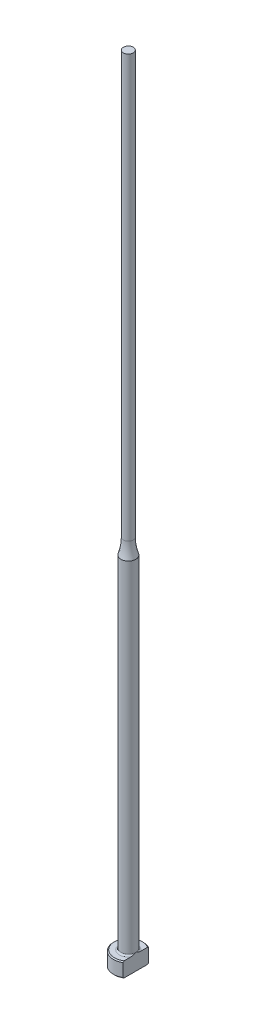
SolidWorks part; units mm, degrees
ref_plane "Front Plane" through (0, 0, 0) normal (0, 0, 1) x (1, 0, 0)
ref_plane "Top Plane" through (0, 0, 0) normal (0, 1, 0) x (1, 0, 0)
ref_plane "Right Plane" through (0, 0, 0) normal (1, 0, 0) x (0, 0, -1)
sketch "Sketch1" plane through (0, 0, 0) normal (0, 0, 1) x (1, 0, 0)
  line L0 (0, 259.9588) -> (0, -15.1925) construction
  line L1 (0, 0) -> (-3, 0)
  line L2 (-3, 0) -> (-3, 3)
  line L3 (-3, 3) -> (-1.5, 3)
  line L4 (-1, 75) -> (-1, 160)
  line L5 (-1, 160) -> (0, 160)
  line L6 (0, 160) -> (0, 0)
  line L7 (-1.5, 3) -> (-1.5, 71.8775)
  arc A0 (-1.5, 71.8775) -> (-1, 75) centre (-11, 75) ccw
  point P13 (-1.5, 0)
  dimension "D1" = 10
  dimension "L" = 160
  dimension "H" = 6
  dimension "T" = 3
  dimension "D" = 2
  dimension "B" = 3
  dimension "S" = 75
revolve "Revolve1" add sketch "Sketch1" angle 360 about L0
chamfer "Chamfer1" distance 0.2 angle 45 2 edges at (0, 3, 3) (0, 0, 3)
fillet "Fillet1" radius 0.3 1 edges at (0, 3, 1.5)
sketch "Sketch2" plane through (0, 0, 0) normal (0, 1, 0) x (1, 0, 0)
  line L0 (1.5, 2.5981) -> (1.5, -2.5981)
  circle A0 centre (0, 0) radius 3 construction
  arc A1 (1.5, -2.5981) -> (1.5, 2.5981) centre (0, 0) ccw
  circle A2 centre (0, 0) radius 1.5 construction
extrude "KEY" cut sketch "Sketch2" along normal through all
